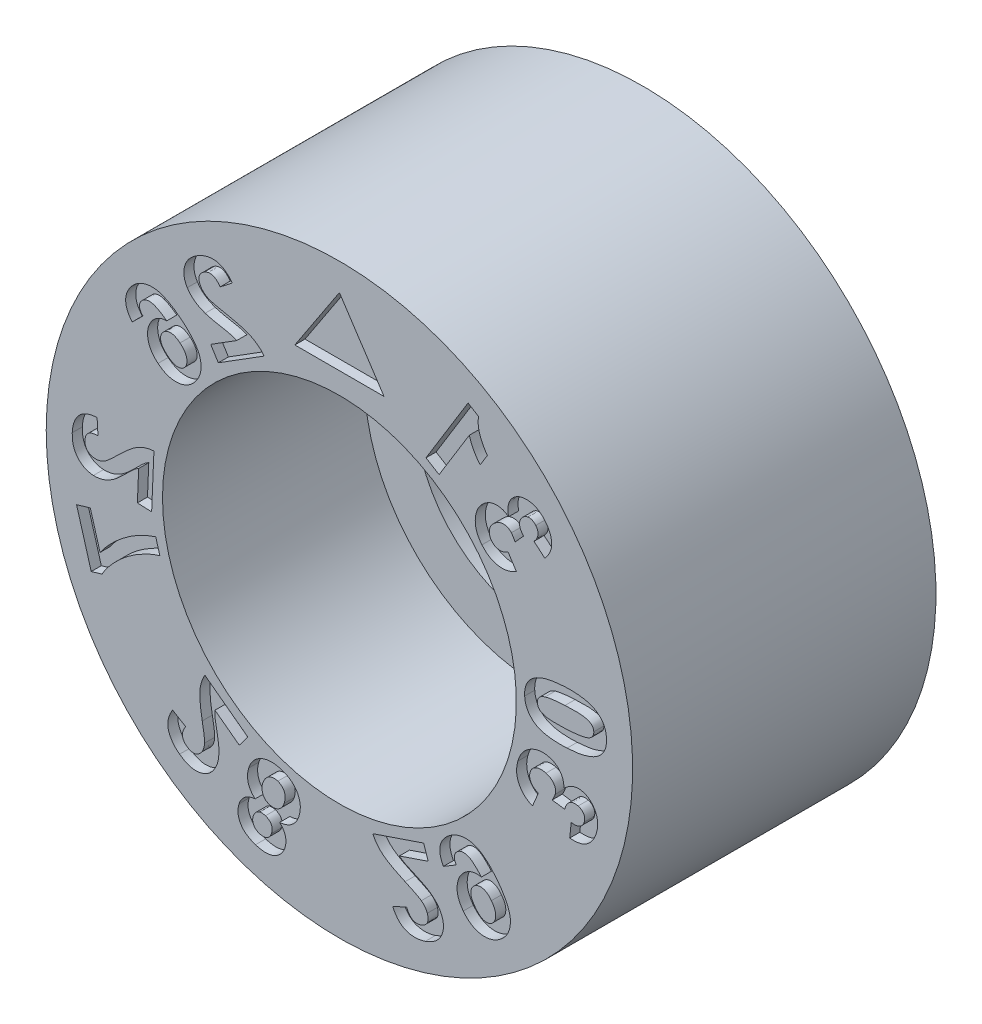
SolidWorks part; units mm, degrees
ref_plane "Front Plane" through (0, 0, 0) normal (0, 0, 1) x (1, 0, 0)
ref_plane "Top Plane" through (0, 0, 0) normal (0, 1, 0) x (1, 0, 0)
ref_plane "Right Plane" through (0, 0, 0) normal (1, 0, 0) x (0, 0, -1)
imported_body "Imported1"
other "Move Face2" parameters "D1"=0.157
other "DeleteFace1"
sketch "Sketch1" plane through (0, 0, 0) normal (0, 0, 1) x (1, 0, 0)
  arc A0 (-0.7207, 1.729) -> (0.7207, 1.729) centre (0, 0) ccw construction
  text T3 "26  27  28  29  30  31" font "Arial" height 0.8
extrude "Cut-Extrude1" cut sketch "Sketch1" against normal blind 0.1
